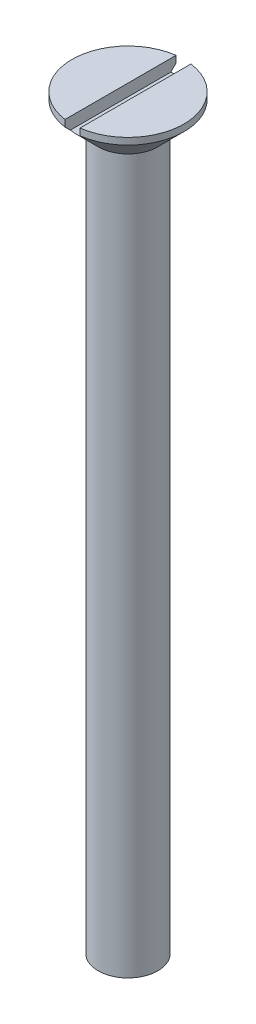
SolidWorks part; units mm, degrees
ref_plane "Aufriss" through (0, 0, 0) normal (0, 0, 1) x (1, 0, 0)
ref_plane "Grundriss" through (0, 0, 0) normal (0, 1, 0) x (1, 0, 0)
ref_plane "Seitenriss" through (0, 0, 0) normal (1, 0, 0) x (0, 0, -1)
sketch "Skizze1" plane through (0, 0, 0) normal (0, 0, 1) x (1, 0, 0)
  line L0 (0, 0) -> (-2, 0)
  line L1 (-2, 0) -> (-2, 47.8)
  line L2 (-2, 47.8) -> (-3.75, 49.55)
  line L3 (-3.75, 49.55) -> (-3.75, 50)
  line L4 (-3.75, 50) -> (0, 50)
  line L5 (0, 50) -> (0, 0) construction
  line L6 (0, 0) -> (0, 50)
  dimension "D1" = 4
  dimension "D2" = 7.5
  dimension "D3" = 45
  dimension "D4" = 2.2
  dimension "D5" = 50
revolve "Rotation1" add sketch "Skizze1" angle 360 about L5
sketch "Skizze2" plane through (0, 0, 0) normal (0, 0, 1) x (1, 0, 0)
  line L0 (3.75, 50) -> (-3.75, 50) construction
  line L1 (-0.5, 50) -> (0.5, 50)
  line L2 (-0.5, 50) -> (-0.5, 49.2)
  line L3 (-0.5, 49.2) -> (0.5, 49.2)
  line L4 (0.5, 50) -> (0.5, 49.2)
  line L5 (0, 0) -> (0, 49.2) construction
  line L6 (-2, 0) -> (2, 0) construction
  dimension "D1" = 1
  dimension "D2" = 0.8
extrude "Schnitt-Linear austragen1" cut sketch "Skizze2" against normal through all both and the other way through all
